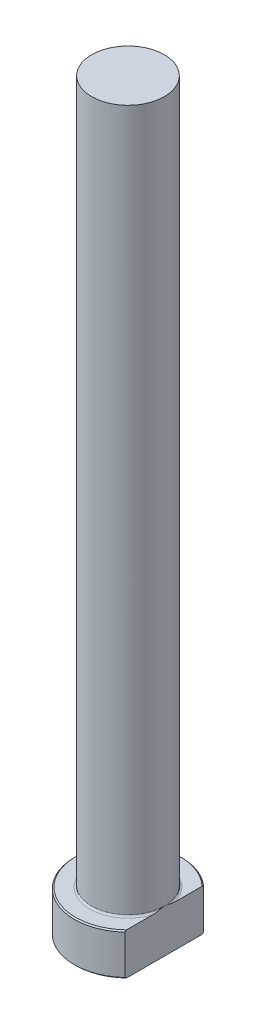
SolidWorks part; units mm, degrees
ref_plane "Front Plane" through (0, 0, 0) normal (0, 0, 1) x (1, 0, 0)
ref_plane "Top Plane" through (0, 0, 0) normal (0, 1, 0) x (1, 0, 0)
ref_plane "Right Plane" through (0, 0, 0) normal (1, 0, 0) x (0, 0, -1)
sketch "Sketch1" plane through (0, 0, 0) normal (0, 0, 1) x (1, 0, 0)
  line L0 (0, 259.9588) -> (0, -15.1925) construction
  line L1 (0, 0) -> (-9, 0)
  line L2 (-9, 0) -> (-9, 7)
  line L3 (-9, 7) -> (-6.1, 7)
  line L4 (-6.1, 7) -> (-6.1, 125)
  line L5 (-6.1, 125) -> (0, 125)
  line L6 (0, 125) -> (0, 0)
  dimension "L" = 125
  dimension "H" = 18
  dimension "T" = 7
  dimension "D" = 12.2
revolve "Revolve1" add sketch "Sketch1" angle 360 about L0
chamfer "Chamfer1" distance 0.2 angle 45 2 edges at (0, 7, 9) (0, 0, 9)
fillet "Fillet1" radius 0.3 1 edges at (0, 7, 6.1)
sketch "Sketch2" plane through (0, 0, 0) normal (0, 1, 0) x (1, 0, 0)
  line L0 (6.1, 6.6174) -> (6.1, -6.6174)
  circle A0 centre (0, 0) radius 9 construction
  arc A1 (6.1, -6.6174) -> (6.1, 6.6174) centre (0, 0) ccw
  circle A2 centre (0, 0) radius 6.1 construction
extrude "KEY" cut sketch "Sketch2" along normal through all
